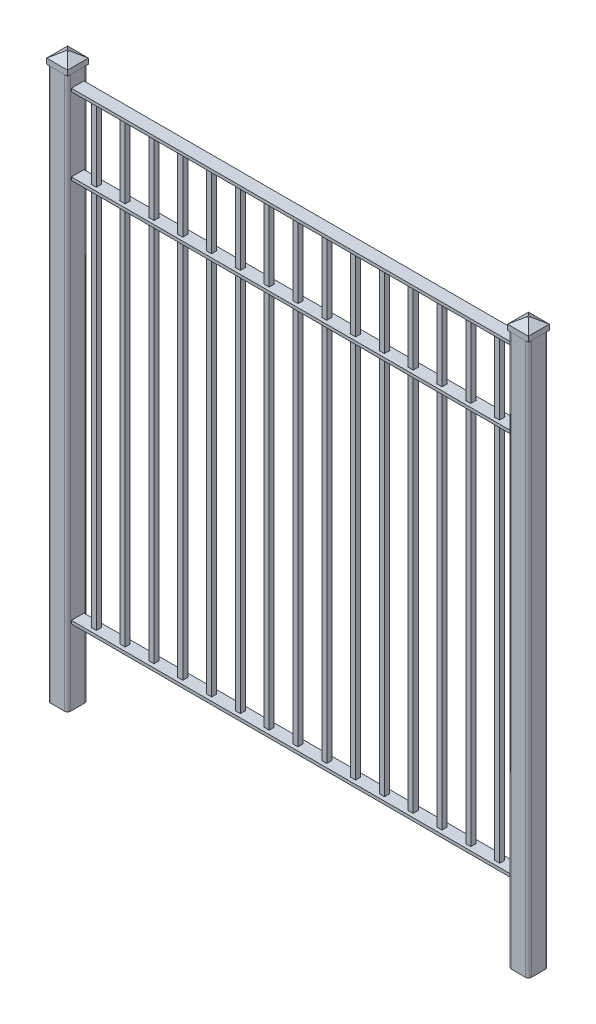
SolidWorks part; units mm, degrees
other "<Fence Post Cap>-<Shell1>"
ref_plane "Front Plane" through (0, 0, 0) normal (0, 0, 1) x (1, 0, 0)
ref_plane "Top Plane" through (0, 0, 0) normal (0, 1, 0) x (1, 0, 0)
ref_plane "Right Plane" through (0, 0, 0) normal (1, 0, 0) x (0, 0, -1)
sketch "Layout" plane through (0, 0, 0) normal (0, 0, 1) x (1, 0, 0)
  line L0 (-914.4, -304.8) -> (-914.4, 1905)
  line L1 (914.4, 1905) -> (914.4, -304.8)
  line L2 (-914.4, 1524) -> (914.4, 1524)
  line L3 (-914.4, 0) -> (914.4, 0)
  line L4 (-800.1, 1828.8) -> (-800.1, 0)
  line L5 (-914.4, 1828.8) -> (914.4, 1828.8)
  dimension "D1" = 1828.8
  dimension "D2" = 2209.8
  dimension "D3" = 1828.8
  dimension "D4" = 304.8
  dimension "D5" = 114.3
  dimension "D6" = 304.8
other "Tube (square) 80 X 80 X 6.3(1)"
ref_plane "Plane1" through (-914.4, -304.8, 0) normal (0, 1, 0) x (-1, 0, 0)
sketch "Sketch1" plane through (-914.4, -304.8, 0) normal (0, 1, 0) x (-1, 0, 0)
  line L0 (-27.4, -33.7) -> (27.4, -33.7)
  line L1 (-33.7, -27.4) -> (-33.7, 27.4)
  line L2 (27.4, 33.7) -> (-27.4, 33.7)
  line L3 (33.7, 27.4) -> (33.7, -27.4)
  line L4 (-27.4, -40) -> (27.4, -40)
  line L5 (-40, -27.4) -> (-40, 27.4)
  line L6 (27.4, 40) -> (-27.4, 40)
  line L7 (40, 27.4) -> (40, -27.4)
  line L8 (-40, 0) -> (-33.7, 0) construction
  line L9 (-33.7, 0) -> (33.7, 0) construction
  line L10 (33.7, 0) -> (40, 0) construction
  line L12 (0, 40) -> (0, 33.7) construction
  line L13 (0, 33.7) -> (0, -33.7) construction
  line L14 (0, -33.7) -> (0, -40) construction
  arc A0 (40, 27.4) -> (27.4, 40) centre (27.4, 27.4) ccw
  arc A1 (27.4, -40) -> (40, -27.4) centre (27.4, -27.4) ccw
  arc A2 (-40, -27.4) -> (-27.4, -40) centre (-27.4, -27.4) ccw
  arc A3 (-27.4, 40) -> (-40, 27.4) centre (-27.4, 27.4) ccw
  arc A4 (-27.4, 33.7) -> (-33.7, 27.4) centre (-27.4, 27.4) ccw
  arc A5 (33.7, 27.4) -> (27.4, 33.7) centre (27.4, 27.4) ccw
  arc A6 (27.4, -33.7) -> (33.7, -27.4) centre (27.4, -27.4) ccw
  arc A7 (-33.7, -27.4) -> (-27.4, -33.7) centre (-27.4, -27.4) ccw
  point P2 (-40, 40)
  point P33 (-40, -40)
  point P34 (40, -40)
  point P36 (40, 40)
  point P37 (0, 0)
  dimension "D1" = 12.6
  dimension "Thickness" = 6.3
  dimension "V_leg" = 80
  dimension "H_leg" = 80
other "Sq and rect bar - configured 12 X 50MM(1)"
ref_plane "Plane2" through (-914.4, 0, 0) normal (1, 0, 0) x (0, 0, 1)
sketch "Sketch11" plane through (-914.4, 0, 0) normal (1, 0, 0) x (0, 0, 1)
  line L1 (-25, -6) -> (25, -6)
  line L2 (-25, -6) -> (-25, 6)
  line L3 (-25, 6) -> (25, 6)
  line L4 (25, -6) -> (25, 6)
  line L5 (0, 6) -> (0, -6) construction
  line L6 (-25, 0) -> (25, 0) construction
  point P0 (0, 0)
  point P4 (0, 0)
  dimension "LENGTH" = 50
  dimension "WIDTH" = 12
other "Sq and rect bar - configured 20 X 20MM(1)"
ref_plane "Plane3" through (-800.1, 1828.8, 0) normal (0, -1, 0) x (1, 0, 0)
sketch "Sketch12" plane through (-800.1, 1828.8, 0) normal (0, -1, 0) x (1, 0, 0)
  line L1 (-10, -10) -> (10, -10)
  line L2 (-10, -10) -> (-10, 10)
  line L3 (-10, 10) -> (10, 10)
  line L4 (10, -10) -> (10, 10)
  line L5 (0, 10) -> (0, -10) construction
  line L6 (-10, 0) -> (10, 0) construction
  point P0 (0, 0)
  point P4 (0, 0)
  dimension "LENGTH" = 20
  dimension "WIDTH" = 20
other "Trim/Extend1"
other "Trim/Extend2"
pattern_linear "LPattern1" count 15 spacing 114.3 along (1, 0, 0)
other "Trim/Extend3"
inserted part "Fence Post Cap"
move or copy body "Body-Move/Copy2" placed by mates yes
mirror "Mirror1" about plane through (0, 0, 0) normal (1, 0, 0)
